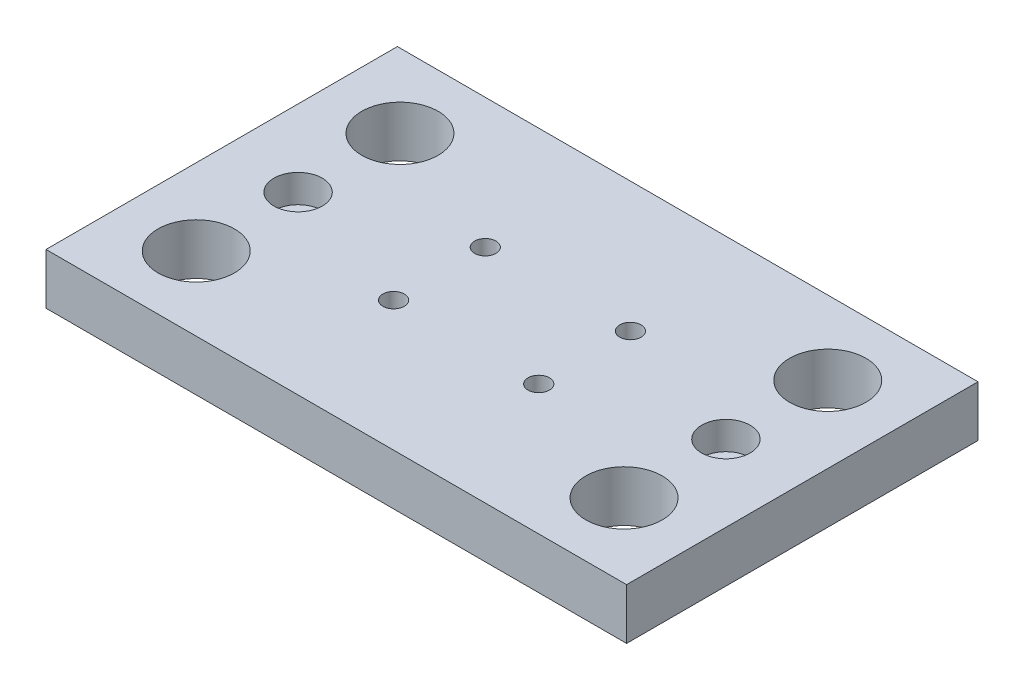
SolidWorks part; units mm, degrees
ref_plane "前视基准面" through (0, 0, 0) normal (0, 0, 1) x (1, 0, 0)
ref_plane "上视基准面" through (0, 0, 0) normal (0, 1, 0) x (1, 0, 0)
ref_plane "右视基准面" through (0, 0, 0) normal (1, 0, 0) x (0, 0, -1)
sketch "草图1" plane through (0, 0, 0) normal (0, 0, 1) x (1, 0, 0)
  line L0 (0, 0) -> (114, 0)
  line L1 (0, 10) -> (114, 10)
  line L2 (0, 0) -> (0, 10)
  line L3 (114, 0) -> (114, 10)
extrude "凸台-拉伸1" add sketch "草图1" along normal blind 69
sketch "草图2" plane through (0, 10, 0) normal (0, 1, 0) x (1, 0, 0)
  circle A0 centre (15, -14.5) radius 7.5
  circle A1 centre (99, -14.5) radius 7.5
  circle A2 centre (99, -54.5) radius 7.5
  circle A3 centre (15, -54.5) radius 7.5
  circle A4 centre (15, -34.5) radius 2.75
  circle A5 centre (99, -34.5) radius 2.75
  circle A6 centre (42.75, -43.5) radius 2.1
  circle A7 centre (42.75, -25.5) radius 2.1
  circle A8 centre (71.25, -25.5) radius 2.1
  circle A9 centre (71.25, -43.5) radius 2.1
extrude "切除-拉伸1" cut sketch "草图2" against normal blind 69
sketch "草图3" plane through (0, 10, 0) normal (0, 1, 0) x (1, 0, 0)
  circle A0 centre (15, -34.5) radius 4.75
  circle A1 centre (99, -34.5) radius 4.75
extrude "切除-拉伸2" cut sketch "草图3" against normal blind 5.5
